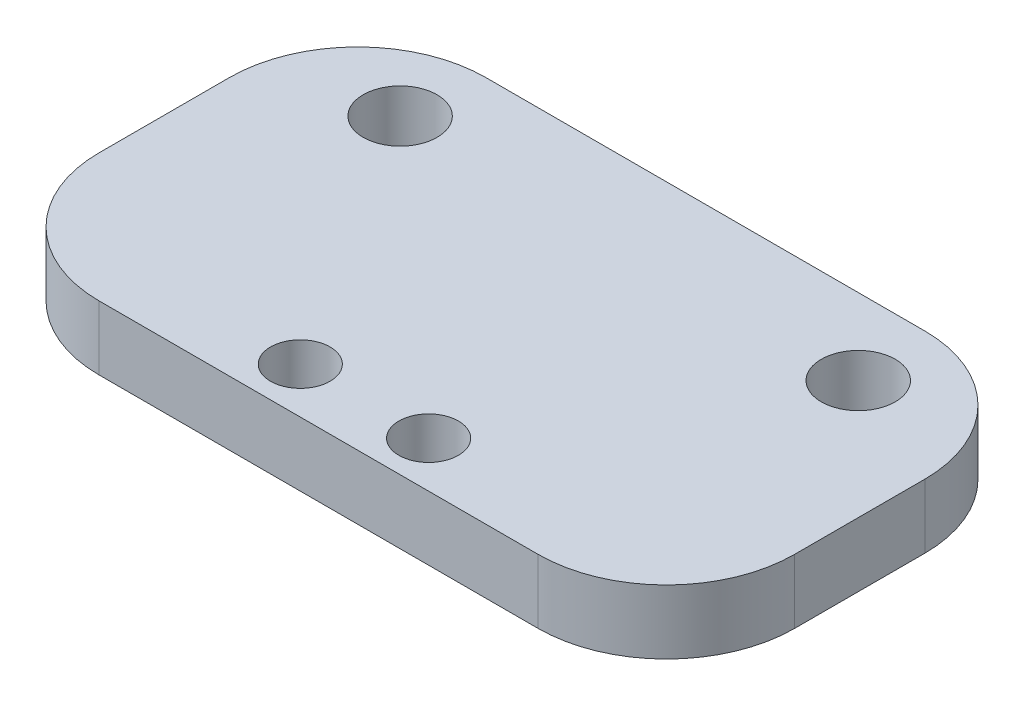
SolidWorks part; units mm, degrees
ref_plane "Front Plane" through (0, 0, 0) normal (0, 0, 1) x (1, 0, 0)
ref_plane "Top Plane" through (0, 0, 0) normal (0, 1, 0) x (1, 0, 0)
ref_plane "Right Plane" through (0, 0, 0) normal (1, 0, 0) x (0, 0, -1)
sketch "Sketch1" plane through (0, 0, 0) normal (0, 1, 0) x (1, 0, 0)
  line L0 (-17.2093, 34.996) -> (-17.2093, 35.0421)
  line L1 (-17.2093, 34.996) -> (-17.2093, 28.6)
  line L2 (17.2093, 28.6) -> (17.2093, 34.996)
  line L3 (-10.8593, 41.3921) -> (10.8593, 41.3921)
  line L4 (-10.8593, 22.25) -> (10.8593, 22.25)
  line L5 (17.2093, 34.996) -> (17.2093, 35.0421)
  arc A0 (-10.8593, 41.3921) -> (-17.2093, 35.0421) centre (-10.8593, 35.0421) ccw
  circle A1 centre (-3.175, 24.5204) radius 1.4732
  circle A2 centre (3.175, 24.5204) radius 1.4732
  arc A3 (-17.2093, 28.6) -> (-10.8593, 22.25) centre (-10.8593, 28.6) ccw
  arc A4 (10.8593, 22.25) -> (17.2093, 28.6) centre (10.8593, 28.6) ccw
  circle A5 centre (-11.3356, 37.6203) radius 1.8288
  circle A6 centre (11.3356, 37.6203) radius 1.8288
  arc A7 (10.8593, 41.3921) -> (17.2093, 35.0421) centre (10.8593, 35.0421) cw
  point P0 (0, 0)
  point P6 (-17.2093, 41.3921)
  dimension "D1" = 6.35
  dimension "D2" = 12.7921
  dimension "D3" = 6.35
extrude "Extrude1" add sketch "Sketch1" along normal blind 3.175
